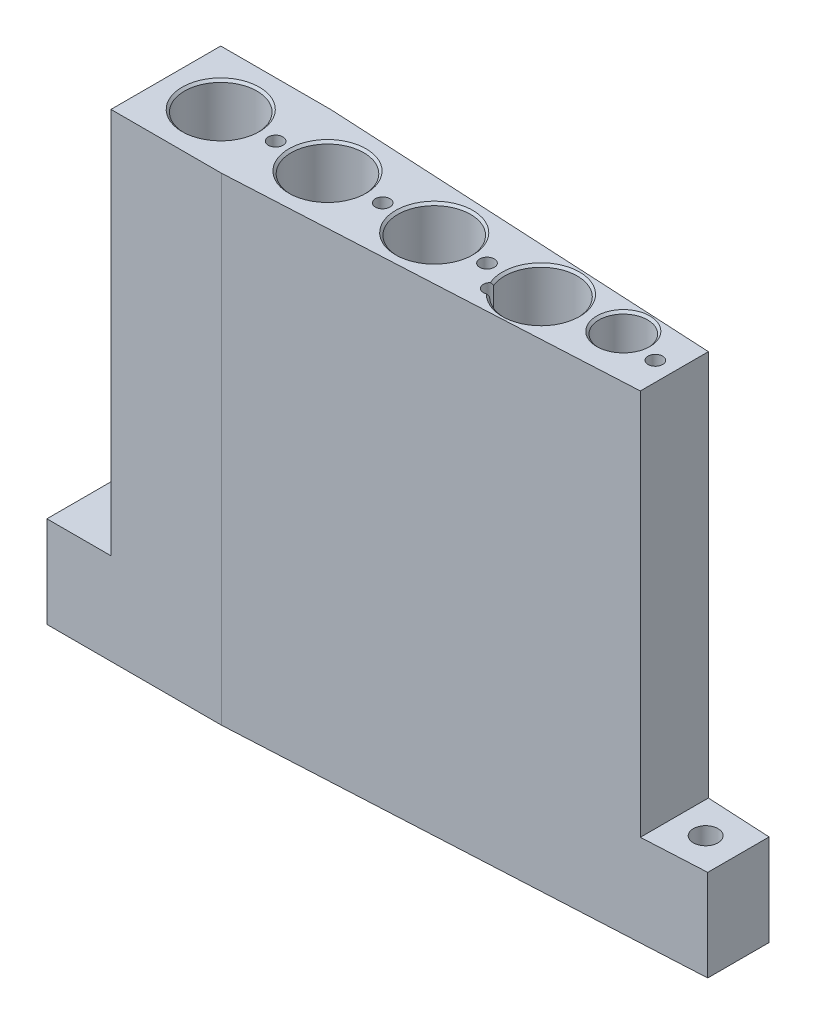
SolidWorks part; units mm, degrees
ref_plane "Front Plane" through (0, 0, 0) normal (0, 0, 1) x (1, 0, 0)
ref_plane "Top Plane" through (0, 0, 0) normal (0, 1, 0) x (1, 0, 0)
ref_plane "Right Plane" through (0, 0, 0) normal (1, 0, 0) x (0, 0, -1)
sketch "Sketch1" plane through (0, 0, 0) normal (0, 1, 0) x (1, 0, 0)
  line L0 (0, 7) -> (0, -7)
  line L1 (0, -10.1273) -> (0, 10.1273) construction
  line L2 (0, -7) -> (69.58, -3.3535)
  line L3 (69.58, -3.3535) -> (69.58, 3.3535)
  line L4 (69.58, 3.3535) -> (0, 7)
  line L5 (-7.8088, 0) -> (87.9118, 0) construction
  line L6 (-25.7125, 0) -> (25.7125, 0) construction
  dimension "D1" = 6
  dimension "D2" = 14
  dimension "D3" = 69.58
extrude "Boss-Extrude1" add sketch "Sketch1" along normal blind 52.25
hole_wizard "5/16 (0.3125) Diameter Hole1" positions "Sketch5" profile "Sketch4" hole size "5/16" standard "ANSI Inch"
sketch "Sketch5" plane through (-12.1053, 52.25, 2.0565) normal (0, 1, 0) x (-1, 0, 0)
  line L0 (-12.1053, 4.5435) -> (-12.1053, -8.6565) construction
  line L1 (16.6322, -2.0565) -> (-40.8428, -2.0565) construction
  point P0 (-25.1053, -2.0565)
  dimension "D1" = 13
sketch "Sketch4" plane through (13, 52.25, 0) normal (1, 0, 0) x (0, 0, 1)
  line L0 (0, 0) -> (0, 40)
  line L1 (0, 40) -> (3.9687, 40)
  line L2 (3.9687, 40) -> (3.9687, 0)
  line L5 (3.9687, 0) -> (0, 0)
  line L10 (0, 40) -> (-3.9688, 40) construction
  line L11 (0, -6.35) -> (0, 107.95) construction
  dimension "Hole Dia." = 7.9375
  dimension "Hole Depth" = 40
  dimension "Drill Angle" = 180
hole_wizard "1/16 (0.0625) Diameter Hole3" positions "Sketch41" profile "Sketch40" hole size "1/16" standard "ANSI Inch"
sketch "Sketch41" plane through (0, 0, 0) normal (0, -1, 0) x (-1, 0, 0)
  line L5 (-28.7375, 0) -> (28.7375, 0) construction
  circle A2 centre (-13, 0) radius 3.9687 construction
  point P0 (-13, 0)
sketch "Sketch40" plane through (13, 0, 0) normal (1, 0, 0) x (0, 0, -1)
  line L0 (0, 0) -> (0, 12.251)
  line L1 (0, 12.251) -> (0.7937, 12.251)
  line L2 (0.7937, 12.251) -> (0.7937, 0)
  line L5 (0.7937, 0) -> (0, 0)
  line L11 (0, -6.35) -> (0, 107.95) construction
  dimension "Thru Hole Dia." = 1.5875
  dimension "Thru Hole Depth" = 12.251
pattern_linear "LPattern1" count 3 spacing 11.6667 along (1, 0, 0) of "5/16 (0.3125) Diameter Hole1", "1/16 (0.0625) Diameter Hole3"
pattern_linear "LPattern2" count 2 spacing 35 along (1, 0, 0) of "5/16 (0.3125) Diameter Hole1"
hole_wizard "1/16 (0.0625) Diameter Hole4" positions "Sketch43" profile "Sketch44" hole size "1/16" standard "ANSI Inch"
sketch "Sketch43" plane through (0, 0, 0) normal (0, -1, 0) x (-1, 0, 0)
  line L6 (-28.7375, 0) -> (28.7375, 0) construction
  line L7 (0, 7.7) -> (0, -7.7) construction
  point P0 (-48.7, 0)
  dimension "D1" = 48.7
sketch "Sketch44" plane through (48.7, 0, 0) normal (1, 0, 0) x (0, 0, -1)
  line L0 (0, 0) -> (0, 12.25)
  line L1 (0, 12.25) -> (0.7937, 12.25)
  line L2 (0.7937, 12.25) -> (0.7937, 0)
  line L5 (0.7937, 0) -> (0, 0)
  line L11 (0, -6.35) -> (0, 107.95) construction
  dimension "Thru Hole Dia." = 1.5875
  dimension "Thru Hole Depth" = 12.25
hole_wizard "#4 (0.209) Diameter Hole1" positions "Sketch13" profile "Sketch12" hole size "#4" standard "ANSI Inch"
sketch "Sketch13" plane through (0, 52.25, 0) normal (0, 1, 0) x (-1, 0, 0)
  line L1 (0, 7.7) -> (0, -7.7) construction
  line L2 (28.7375, 0) -> (-28.7375, 0) construction
  point P0 (-56, -1)
  dimension "D1" = 56
  dimension "D2" = 1
sketch "Sketch12" plane through (56, 52.25, -1) normal (1, 0, 0) x (0, 0, 1)
  line L0 (0, 0) -> (0, 52.25)
  line L1 (0, 52.25) -> (2.6543, 52.25)
  line L2 (2.6543, 52.25) -> (2.6543, 0)
  line L5 (2.6543, 0) -> (0, 0)
  line L11 (0, -6.35) -> (0, 107.95) construction
  dimension "Thru Hole Dia." = 5.3086
  dimension "Thru Hole Depth" = 52.25
sketch "Sketch14" plane through (52.25, 52.25, 0) normal (0, -1, 0) x (0, 0, 1)
  line L1 (-7, 52.25) -> (7, 52.25)
  line L2 (-7, 52.25) -> (-7, 45.25)
  line L3 (-7, 45.25) -> (7, 45.25)
  line L4 (7, 52.25) -> (7, 45.25)
  line L6 (7, 52.25) -> (3.3535, -17.33) construction
  line L8 (-7, 52.25) -> (7, 52.25) construction
  line L9 (3.7203, -10.33) -> (-3.7203, -10.33)
  line L10 (3.7203, -10.33) -> (3.7203, -17.33)
  line L11 (3.7203, -17.33) -> (-3.7203, -17.33)
  line L12 (-3.7203, -10.33) -> (-3.7203, -17.33)
  line L13 (-3.3535, -17.33) -> (-7, 52.25) construction
  line L14 (3.3535, -17.33) -> (-3.3535, -17.33) construction
  dimension "D1" = 7
  dimension "D2" = 7
extrude "Cut-Extrude1" cut sketch "Sketch14" along normal blind 42.25
hole_wizard "M2.5 Clearance Hole1" positions "Sketch16" profile "Sketch17" hole size "M2.5" standard "Ansi Metric"
sketch "Sketch16" plane through (-31.3789, 10, -5.8188) normal (0, 1, 0) x (-1, 0, 0)
  line L0 (-31.3789, 13.5188) -> (-31.3789, -1.8812) construction
  line L1 (-2.6414, 5.8188) -> (-60.1164, 5.8188) construction
  line L4 (-31.3789, 12.8188) -> (-31.3789, -1.1812) construction
  point P0 (-34.8789, 5.8188)
  point P6 (-97.3789, 5.8188)
  dimension "D1" = 3.5
  dimension "D2" = 66
sketch "Sketch17" plane through (3.5, 10, 0) normal (1, 0, 0) x (0, 0, 1)
  line L0 (0, 0) -> (0, 10)
  line L1 (0, 10) -> (1.35, 10)
  line L2 (1.35, 10) -> (1.35, 0)
  line L5 (1.35, 0) -> (0, 0)
  line L11 (0, -6.35) -> (0, 107.95) construction
  dimension "Thru Hole Dia." = 2.7
  dimension "Thru Hole Depth" = 10
hole_wizard "1/16 (0.0625) Diameter Hole1" positions "Sketch23" profile "Sketch22" hole size "1/16" standard "ANSI Inch"
sketch "Sketch23" plane through (0, 0, 0) normal (0, -1, 0) x (1, 0, 0)
  line L1 (0, -7.7) -> (0, 7.7) construction
  line L2 (28.7375, 0) -> (-28.7375, 0) construction
  point P0 (8, 0)
  point P1 (62, 0)
  dimension "D1" = 8
  dimension "D2" = 54
sketch "Sketch22" plane through (8, 0, 0) normal (1, 0, 0) x (0, 0, -1)
  line L0 (0, 0) -> (0, 5)
  line L1 (0, 5) -> (0.7937, 5)
  line L2 (0.7937, 5) -> (0.7937, 0)
  line L5 (0.7937, 0) -> (0, 0)
  line L10 (0, 5) -> (-0.7938, 5) construction
  line L11 (0, -6.35) -> (0, 107.95) construction
  dimension "Hole Dia." = 1.5875
  dimension "Hole Depth" = 5
  dimension "Drill Angle" = 180
ref_plane "Plane1" through (0, 0, -1) normal (0, 0, 1) x (1, 0, 0)
hole_wizard "1/16 (0.0625) Diameter Hole2" positions "Sketch32" profile "Sketch31" hole size "1/16" standard "ANSI Inch"
sketch "Sketch32" plane through (0, 52.25, 0) normal (0, 1, 0) x (1, 0, 0)
  line L1 (-28.7375, 0) -> (28.7375, 0) construction
  circle A7 centre (48, 0) radius 3.9687 construction
  point P13 (44.6968, -2.2)
  dimension "D1" = 2.2
sketch "Sketch31" plane through (44.6968, 52.25, 2.2) normal (1, 0, 0) x (0, 0, 1)
  line L0 (0, 0) -> (0, 6.4769)
  line L1 (0, 6.4769) -> (0.7937, 6)
  line L2 (0.7937, 6) -> (0.7937, 0)
  line L5 (0.7937, 0) -> (0, 0)
  line L10 (0, 6.4769) -> (-0.7938, 6) construction
  line L11 (0, -6.35) -> (0, 107.95) construction
  dimension "Hole Dia." = 1.5875
  dimension "Hole Depth" = 6
  dimension "Drill Angle" = 118
hole_wizard "M2x0.4 Tapped Hole2" positions "Sketch37" profile "Sketch36" tap size "M2x0.4" standard "ANSI Metric"
sketch "Sketch37" plane through (0, 52.25, 0) normal (0, 1, 0) x (1, 0, 0)
  line L0 (0, -7.7) -> (0, 7.7) construction
  line L1 (-28.7375, 0) -> (28.7375, 0) construction
  point P0 (19, 0)
  point P2 (30.7, 0)
  point P4 (42.1, 0)
  point P6 (60.5, 0)
  dimension "D1" = 19
  dimension "D2" = 30.7
  dimension "D3" = 42.1
  dimension "D4" = 60.5
sketch "Sketch36" plane through (19, 52.25, 0) normal (1, 0, 0) x (0, 0, 1)
  line L0 (0, 0) -> (0, 5.6807)
  line L1 (0, 5.6807) -> (0.8, 5.2)
  line L2 (0.8, 5.2) -> (0.8, 0)
  line L5 (0.8, 0) -> (0, 0)
  line L10 (0, 5.6807) -> (-0.8, 5.2) construction
  line L11 (0, -6.35) -> (0, 107.95) construction
  dimension "Tap Drill Dia." = 1.6
  dimension "Tap Drill Depth" = 5.2
  dimension "Drill Angle" = 118
sketch "Sketch38" plane through (0, 0, 0) normal (0, 0, 1) x (1, 0, 0)
  line L0 (11.7, 13.7956) -> (11.7, 5.6926) construction
  line L1 (0, -7.7) -> (0, 7.7) construction
  line L2 (0, 0) -> (69.58, 0) construction
  line L3 (11.7, 11.5812) -> (11.7, 6.8188)
  arc A0 (11.7, 11.5812) -> (11.7, 6.8188) centre (11.7, 9.2) ccw
  dimension "D1" = 2.3813
  dimension "D2" = 11.7
  dimension "D3" = 9.2
revolve "Cut-Revolve2" [suppressed] cut sketch "Sketch38" angle 360 about L0
sketch "Sketch42" plane through (0, 0, 0) normal (0, 1, 0) x (1, 0, 0)
  line L0 (0, 6) -> (19.0811, 6)
  line L1 (0, -7) -> (0, 7) construction
  line L2 (62.58, 3.7203) -> (7, 6.6331) construction
  line L3 (19.0811, 6) -> (69.58, 3.3535)
  line L4 (69.58, 3.3535) -> (69.58, -3.3535)
  line L5 (69.58, -3.3535) -> (19.0811, -6)
  line L6 (7, -6.6331) -> (62.58, -3.7203) construction
  line L7 (19.0811, -6) -> (0, -6)
  line L8 (0, -6) -> (0, 6)
  dimension "D1" = 12
extrude "Cut-Extrude2" cut sketch "Sketch42" along normal through all flip side to cut
chamfer "Chamfer2" distance 0.9333 angle 30 1 edges at (48.7, 0, -0.7937)
chamfer "Chamfer3" distance 0.25 angle 45 5 edges at (56, 52.25, 1.6543) (51.3032, 52.25, -2.2) (36.3333, 52.25, 3.9687) (24.6667, 52.25, 3.9687) (13, 52.25, 3.9687)
